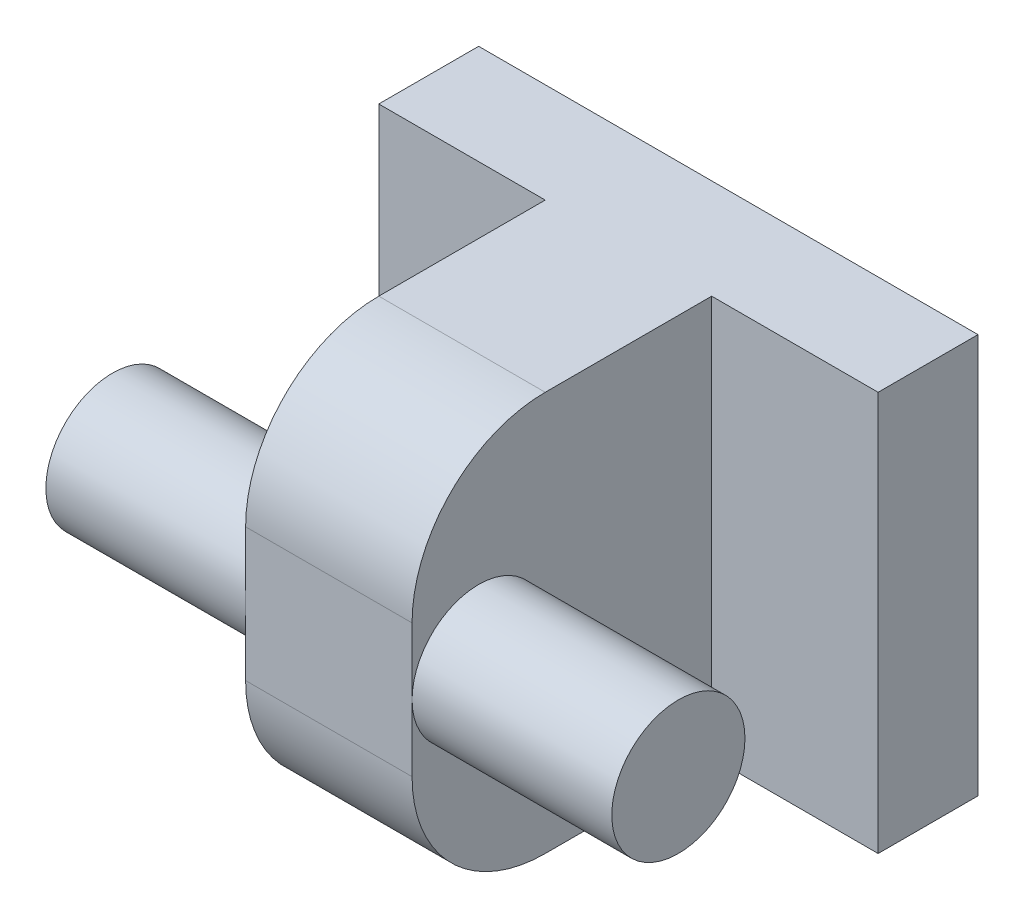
SolidWorks part; units mm, degrees
ref_plane "正面" through (0, 0, 0) normal (0, 0, 1) x (1, 0, 0)
ref_plane "平面" through (0, 0, 0) normal (0, 1, 0) x (1, 0, 0)
ref_plane "右側面" through (0, 0, 0) normal (1, 0, 0) x (0, 0, -1)
sketch "ｽｹｯﾁ1" plane through (0, 0, 0) normal (0, 0, 1) x (1, 0, 0)
  line L1 (0, 0) -> (150, 0)
  line L2 (0, 0) -> (0, 120)
  line L3 (0, 120) -> (150, 120)
  line L4 (150, 0) -> (150, 120)
  dimension "D1" = 150
  dimension "D2" = 120
extrude "押し出し1" add sketch "ｽｹｯﾁ1" along normal blind 30
sketch "ｽｹｯﾁ2" plane through (0, 0, 30) normal (0, 0, 1) x (1, 0, 0)
  line L0 (0, 0) -> (150, 0) construction
  line L1 (50, 0) -> (100, 0)
  line L2 (50, 0) -> (50, 120)
  line L3 (50, 120) -> (100, 120)
  line L4 (100, 0) -> (100, 120)
  line L5 (150, 120) -> (0, 120) construction
  line L6 (150, 0) -> (150, 120) construction
  line L7 (0, 120) -> (0, 0) construction
  dimension "D1" = 50
  dimension "D2" = 50
extrude "押し出し2" add sketch "ｽｹｯﾁ2" along normal blind 90
sketch "ｽｹｯﾁ3" plane through (100, 0, 0) normal (1, 0, 0) x (0, 0, -1)
  line L0 (-120, 0) -> (-30, 0) construction
  line L2 (0, 0) -> (0, 120) construction
  circle A0 centre (-100, 60) radius 20
  dimension "D1" = 40
  dimension "D2" = 60
  dimension "D3" = 100
extrude "押し出し3" add sketch "ｽｹｯﾁ3" along normal blind 60 and the other way blind 110
fillet "ﾌｨﾚｯﾄ1" radius 40 2 edges at (75, 120, 120) (75, 0, 120)
sketch "ｽｹｯﾁ4" plane through (0, 0, 0) normal (0, 0, -1) x (-1, 0, 0)
  line L0 (0, 0) -> (-150, 0) construction
  line L1 (-150, 0) -> (-150, 120) construction
  circle A0 centre (-75, 60) radius 20
  dimension "D1" = 40
  dimension "D2" = 60
  dimension "D3" = 75
extrude "押し出し4" cut sketch "ｽｹｯﾁ4" against normal blind 40
